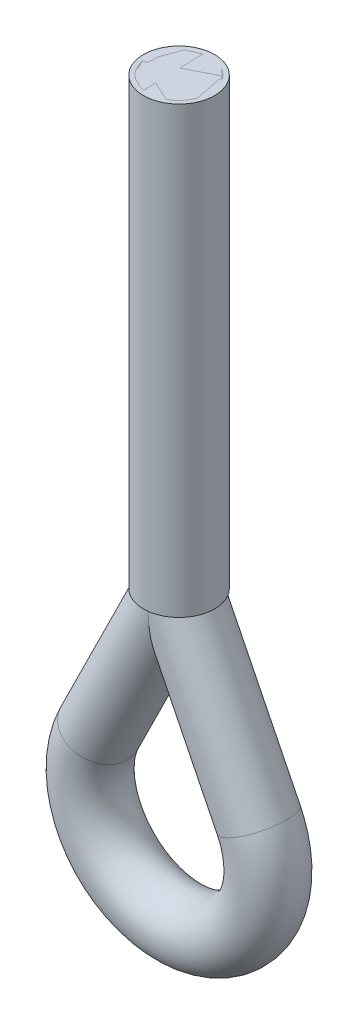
SolidWorks part; units mm, degrees
ref_plane "Front Plane" through (0, 0, 0) normal (0, 0, 1) x (1, 0, 0)
ref_plane "Top Plane" through (0, 0, 0) normal (0, 1, 0) x (1, 0, 0)
ref_plane "Right Plane" through (0, 0, 0) normal (1, 0, 0) x (0, 0, -1)
sketch "Sketch1" plane through (0, 0, 0) normal (0, 0, 1) x (1, 0, 0)
  line L0 (-35.8323, 17.7778) -> (0, 90)
  line L1 (0, 90) -> (0, 290)
  line L2 (35.8323, 17.7778) -> (0.8889, 88.2084)
  line L3 (0.8889, 88.2084) -> (0, 90) construction
  arc A0 (-35.8323, 17.7778) -> (35.8323, 17.7778) centre (0, 0) ccw
  point P8 (0, 0)
  dimension "D1" = 80
  dimension "D2" = 2
  dimension "D3" = 90
  dimension "D4" = 200
other "Bolt Ø30(1)"
ref_plane "Plane1" through (0, 90, 0) normal (0, 1, 0) x (-1, 0, 0)
sketch "Sketch11" plane through (0, 90, 0) normal (0, 1, 0) x (-1, 0, 0)
  circle A1 centre (0, 0) radius 14
  point P1 (14, 0)
  point P3 (0, -14)
  point P5 (-14, 0)
  point P6 (0, 14)
  point P7 (0, 0)
  dimension "Out_dia" = 28
sketch "Sketch12" plane through (0, 290, 0) normal (0, 1, 0) x (1, 0, 0)
  circle A0 centre (0, 0) radius 16
  dimension "D1" = 32
extrude "Boss-Extrude1" add sketch "Sketch12" against normal up to vertex separate body
